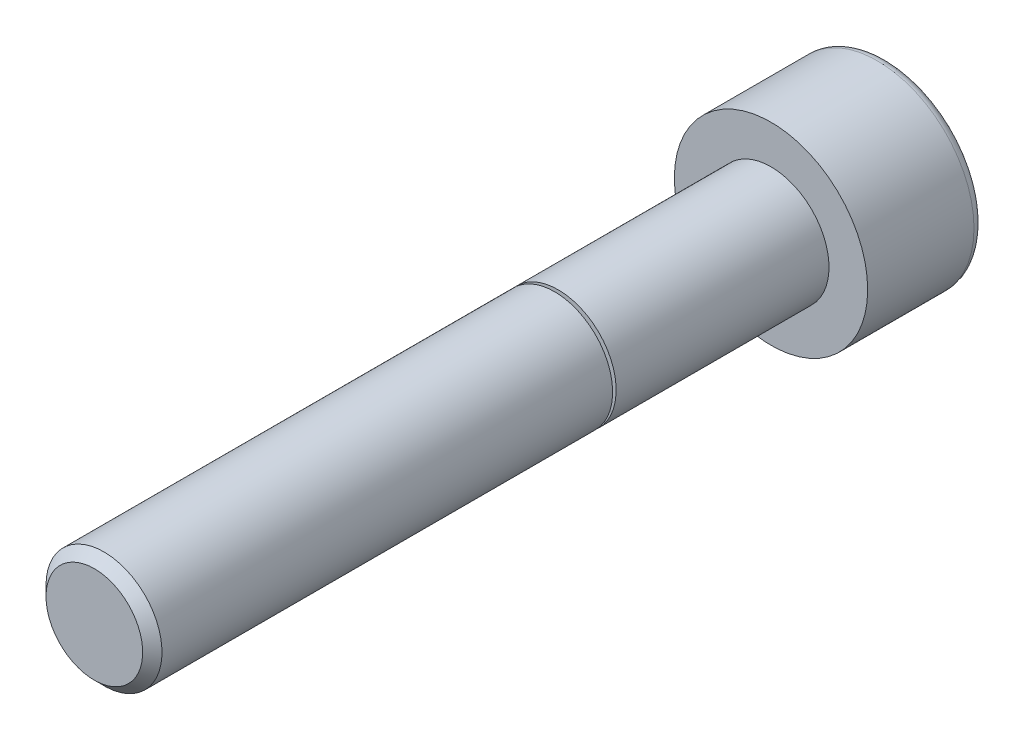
SolidWorks part; units mm, degrees
ref_plane "Front" through (0, 0, 0) normal (0, 0, 1) x (1, 0, 0)
ref_plane "Top" through (0, 0, 0) normal (0, 1, 0) x (1, 0, 0)
ref_plane "Right" through (0, 0, 0) normal (1, 0, 0) x (0, 0, -1)
sketch "Logo3_Revol_Axis" plane through (0, 0, 0) normal (0, 1, 0) x (1, 0, 0)
  line L0 (0, -43.5172) -> (0, 43.5172) construction
sketch "Logo3_bib1" plane through (0, 0, 0) normal (0, -1, 0) x (-1, 0, 0)
  line L0 (0, -35) -> (0, 6)
  line L1 (0, 6) -> (4.5, 6)
  line L2 (5, 5.5) -> (5, 0)
  line L3 (5, 0) -> (3, 0)
  line L4 (3, 0) -> (3, -11.01)
  line L5 (3, -34.5) -> (2.5, -35)
  line L6 (2.5, -35) -> (0, -35)
  line L7 (3, -11.01) -> (2.6134, -11.01)
  line L8 (2.6066, -11.0488) -> (3, -11.192)
  line L9 (3, -11.192) -> (3, -34.5)
  line L10 (0, 10.5852) -> (0, -63.2873) construction
  arc A0 (4.5, 6) -> (5, 5.5) centre (4.5, 5.5) cw
  arc A1 (2.6134, -11.01) -> (2.6066, -11.0488) centre (2.6134, -11.03) ccw
  point P17 (2.5, -11.01)
revolve "Revolve1" add sketch "Logo3_bib1" angle 360 about L10
sketch "Logo3_bib2" plane through (0, 0, -6) normal (0, 0, -1) x (1, 0, 0)
  line L1 (2.8868, 0) -> (1.4434, 2.5)
  line L2 (1.4434, 2.5) -> (-1.4434, 2.5)
  line L3 (-1.4434, 2.5) -> (-2.8868, 0)
  line L4 (-2.8868, 0) -> (-1.4434, -2.5)
  line L5 (-1.4434, -2.5) -> (1.4434, -2.5)
  line L6 (1.4434, -2.5) -> (2.8868, 0)
  circle A0 centre (0, 0) radius 2.5 construction
extrude "Cut-Extrude1" cut sketch "Logo3_bib2" against normal blind 2.5
equation "\"DIA2@Logo3_bib1\" = \"Logo3_d1-pas@Logo3_bib1\""
equation "\"LGT1@Logo3_bib1\" = \"Logo3_d1@Logo3_bib1\""
equation "\"D1@Cut-Extrude1\" = \"Logo3_c1@Logo3_bib2\"/2."
equation "\"D2@Cosmetic Thread1\" = \"Logo3_d1-pas@Logo3_bib1\""
